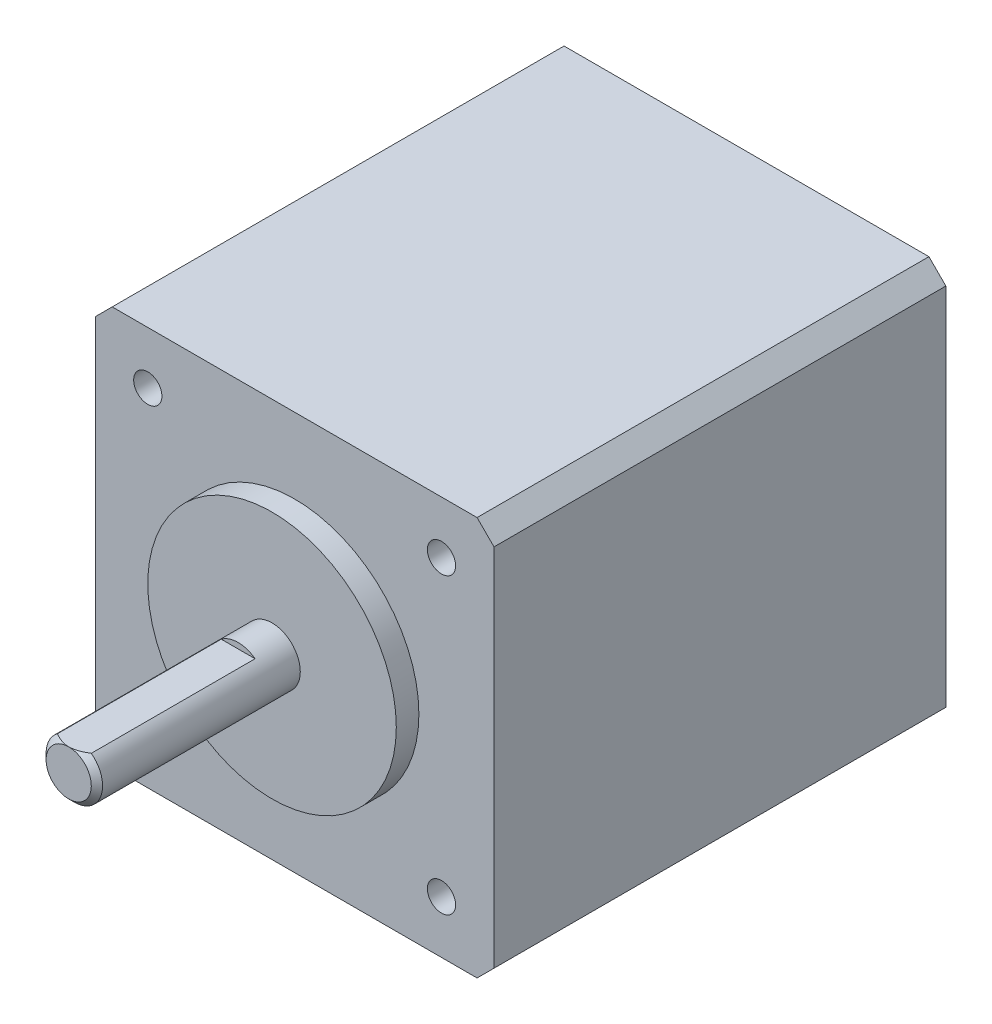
SolidWorks part; units mm, degrees
ref_plane "前视基准面" through (0, 0, 0) normal (0, 0, 1) x (1, 0, 0)
ref_plane "上视基准面" through (0, 0, 0) normal (0, 1, 0) x (1, 0, 0)
ref_plane "右视基准面" through (0, 0, 0) normal (1, 0, 0) x (0, 0, -1)
sketch "草图1" plane through (0, 0, 0) normal (0, 0, 1) x (1, 0, 0)
  circle A0 centre (0, 0) radius 11
extrude "凸台-拉伸1" add sketch "草图1" against normal blind 2
sketch "草图2" plane through (0, 0, 0) normal (0, 0, 1) x (1, 0, 0)
  circle A0 centre (0, 0) radius 2.5
extrude "凸台-拉伸2" add sketch "草图2" along normal blind 18
sketch "草图3" plane through (0, 0, 18) normal (0, 0, 1) x (1, 0, 0)
  line L1 (0, 2) -> (2.5, 2)
  line L2 (2.5, 2) -> (2.5, 3.5195)
  line L3 (2.5, 3.5195) -> (-3.2545, 3.5195)
  line L4 (-3.2545, 3.5195) -> (-3.2545, 2)
  line L5 (-3.2545, 2) -> (0, 2)
extrude "切除-拉伸1" cut sketch "草图3" against normal blind 15
sketch "草图4" plane through (0, 0, -2) normal (0, 0, -1) x (-1, 0, 0)
  line L0 (-17.65, 16.15) -> (-16.15, 17.65)
  line L1 (0, 17.65) -> (16.15, 17.65)
  line L2 (17.65, 16.15) -> (17.65, -16.15)
  line L3 (16.15, -17.65) -> (-16.15, -17.65)
  line L4 (-17.65, -16.15) -> (-17.65, 16.15)
  line L5 (-16.15, 17.65) -> (0, 17.65)
  line L6 (16.15, 17.65) -> (17.65, 16.15)
  line L7 (17.65, -16.15) -> (16.15, -17.65)
  line L8 (-16.15, -17.65) -> (-17.65, -16.15)
  point P3 (17.65, 17.65)
  point P4 (17.65, -17.65)
  point P5 (-17.65, -17.65)
  point P7 (-17.65, 17.65)
extrude "凸台-拉伸3" add sketch "草图4" along normal blind 40
sketch "草图5" plane through (0, 0, -2) normal (0, 0, 1) x (1, 0, 0)
  point P8 (-13, 13)
  point P9 (13, 13)
  point P10 (13, -13)
  point P11 (-13, -13)
hole_wizard "M3 螺纹孔1" positions "草图7" profile "草图6" tap size "M3" standard "GB"
sketch "草图7" plane through (0, 0, -2) normal (0, 0, 1) x (1, 0, 0)
  point P0 (-13, 13)
  point P3 (13, 13)
  point P6 (13, -13)
  point P9 (-13, -13)
sketch "草图6" plane through (-13, 13, -2) normal (1, 0, 0) x (0, -1, 0)
  line L0 (0, 0) -> (0, 5.7511)
  line L1 (0, 5.7511) -> (1.25, 5)
  line L2 (1.25, 5) -> (1.25, 0)
  line L5 (1.25, 0) -> (0, 0)
  line L10 (0, 5.7511) -> (-1.25, 5) construction
  line L11 (0, -6.35) -> (0, 107.95) construction
  dimension "螺纹孔钻头直径" = 2.5
  dimension "螺纹孔钻头深度" = 5
  dimension "导头角度" = 118
chamfer "倒角1" distance 0.5 angle 45 1 edges at (0, -2.5, 18)
